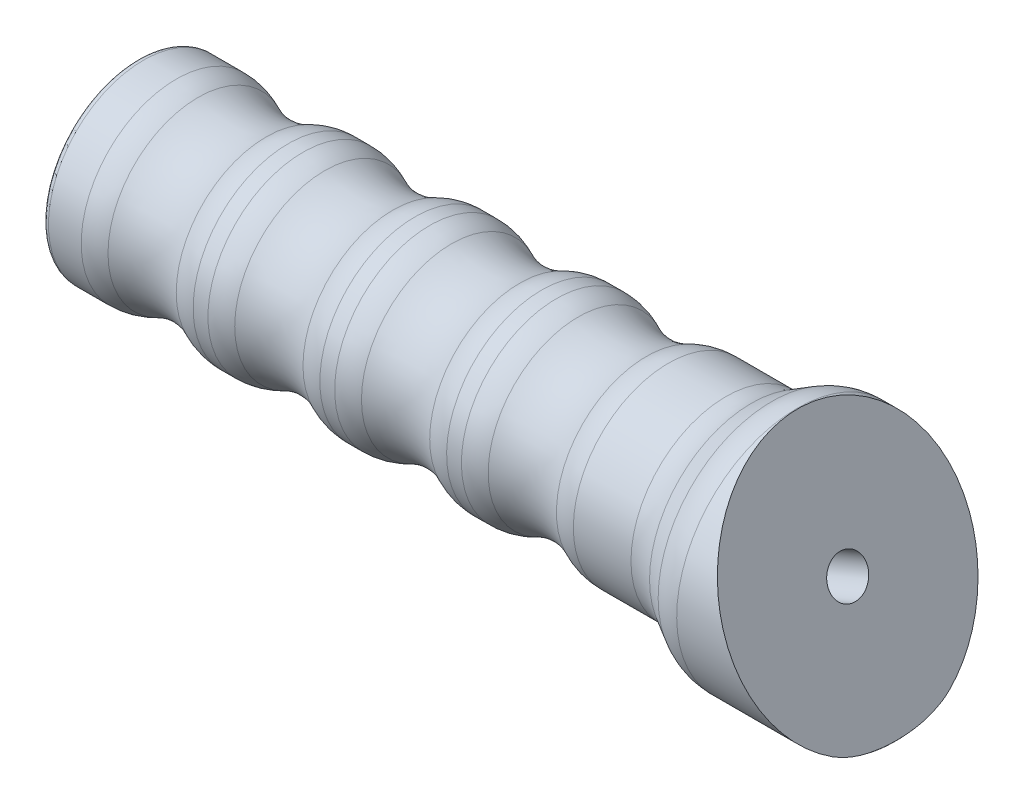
SolidWorks part; units mm, degrees
ref_plane "Plan de face" through (0, 0, 0) normal (0, 0, 1) x (1, 0, 0)
ref_plane "Plan de dessus" through (0, 0, 0) normal (0, 1, 0) x (1, 0, 0)
ref_plane "Plan de droite" through (0, 0, 0) normal (1, 0, 0) x (0, 0, -1)
sketch "Esquisse1" plane through (0, 0, 0) normal (0, 0, 1) x (1, 0, 0)
  line L0 (0, 0) -> (152.4771, 0) construction
  line L1 (0, 0) -> (0, 15)
  line L3 (2.4511, 25.5) -> (112.9571, 25.5) construction
  line L4 (0, 15) -> (8.2177, 15)
  line L5 (21.7823, 15) -> (28.2177, 15)
  line L6 (41.7823, 15) -> (48.2177, 15)
  line L7 (61.7823, 15) -> (68.2177, 15)
  line L8 (81.7823, 15) -> (95.0718, 15)
  line L10 (95.0718, 15) -> (102, 19)
  line L11 (102, 19) -> (120, 19)
  line L12 (120, 19) -> (120, 0)
  line L16 (0, 0) -> (120, 0)
  arc A0 (8.2177, 15) -> (21.7823, 15) centre (15, 25.5) ccw
  arc A1 (28.2177, 15) -> (41.7823, 15) centre (35, 25.5) ccw
  arc A2 (48.2177, 15) -> (61.7823, 15) centre (55, 25.5) ccw
  arc A3 (68.2177, 15) -> (81.7823, 15) centre (75, 25.5) ccw
  dimension "D1" = 25
  dimension "D3" = 26
  dimension "D13" = 20
  dimension "D14" = 20
  dimension "D15" = 20
  dimension "D17" = 15
  dimension "D2" = 30
  dimension "D5" = 30
  dimension "D6" = 38
  dimension "D11" = 120
  dimension "D12" = 18
  dimension "D16" = 13.2895
revolve "Révolution1" add sketch "Esquisse1" angle 360 about L0
fillet "Congé1" radius 1 2 edges at (0, 0, 15) (120, 0, 19)
fillet "Congé2" radius 8 10 edges at (21.7823, 0, 15) (8.2177, 0, 15) (41.7823, 0, 15) (28.2177, 0, 15) (61.7823, 0, 15) (48.2177, 0, 15) (81.7823, 0, 15) (68.2177, 0, 15) (102, 0, 19) (95.0718, 0, 15)
sketch "Esquisse2" plane through (0, 0, 0) normal (0, 0, 1) x (1, 0, 0)
  line L0 (120, -18) -> (120, 18) construction
  line L1 (120, -19) -> (120, 18)
  line L2 (119, 19) -> (104.1436, 19) construction
  line L3 (119, 19) -> (104.2599, 19)
  line L4 (104.1436, -19) -> (119, -19) construction
  line L5 (120, -19) -> (104.2599, 19)
  arc A0 (120, 18) -> (119, 19) centre (119, 18) ccw construction
  arc A1 (120, 18) -> (119, 19) centre (119, 18) ccw
  dimension "D1" = 22.5
extrude "Enlèv. mat.-Extru.1" cut sketch "Esquisse2" against normal through all and the other way through all
hole_wizard "Diamètre du perçage Ø6.2 (6.2)1" positions "Esquisse4" profile "Esquisse3" hole size "Ø6.2" standard "ISO"
sketch "Esquisse4" plane through (95.7089, 39.6439, 0) normal (0.9239, 0.3827, 0) x (0, 0, -1)
  ellipse E0 centre (0, -42.9103) end of major axis (0, -63.4757) minor radius 19 (9.2689, -60.8626) -> (-9.2689, -60.8626) ccw construction
  point P0 (0, -42.9103)
sketch "Esquisse3" plane through (112.1299, 0, 0) normal (0, 0, 1) x (-0.3827, 0.9239, 0)
  line L0 (0, 0) -> (0, 31.8627)
  line L1 (0, 31.8627) -> (3.1, 30)
  line L2 (3.1, 30) -> (3.1, 0)
  line L5 (3.1, 0) -> (0, 0)
  line L10 (0, 31.8627) -> (-3.1, 30) construction
  line L11 (0, -6.35) -> (0, 107.95) construction
  dimension "Diamètre du perçage" = 6.2
  dimension "Profondeur du perçage" = 30
  dimension "Angle de pointe" = 118
ref_plane "Plan1" through (44.8955, 18.5963, 0) normal (0.9239, 0.3827, 0) x (0, 0, -1)
sketch "Esquisse5" plane through (44.8955, 18.5963, 0) normal (0.9239, 0.3827, 0) x (0, 0, -1)
  circle A0 centre (0, -42.9103) radius 5.5
  dimension "D1" = 11
extrude "Enlèv. mat.-Extru.2" cut sketch "Esquisse5" along normal blind 37
